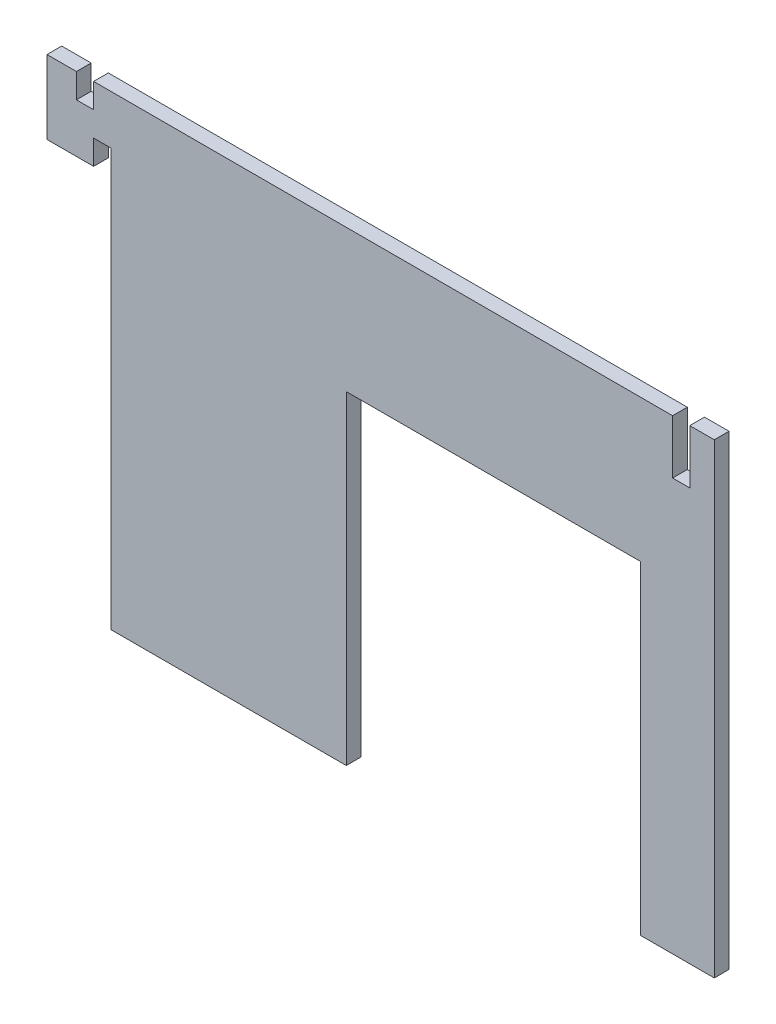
SolidWorks part; units mm, degrees
ref_plane "Plan de face" through (0, 0, 0) normal (0, 0, 1) x (1, 0, 0)
ref_plane "Plan de dessus" through (0, 0, 0) normal (0, 1, 0) x (1, 0, 0)
ref_plane "Plan de droite" through (0, 0, 0) normal (1, 0, 0) x (0, 0, -1)
sketch "Esquisse1" plane through (0, 0, 0) normal (0, 0, 1) x (1, 0, 0)
  line L1 (0, 0) -> (136, 0)
  line L2 (0, 0) -> (0, 95)
  line L3 (0, 95) -> (136, 95)
  line L4 (136, 0) -> (136, 95)
  dimension "D1" = 95
  dimension "D2" = 136
extrude "Extrusion1" add sketch "Esquisse1" along normal blind 3
sketch "Esquisse2" plane through (0, 0, 3) normal (0, 0, 1) x (1, 0, 0)
  line L0 (0, 95) -> (0, 0) construction
  line L1 (0, 80) -> (13, 80)
  line L2 (0, 80) -> (0, 0)
  line L3 (0, 0) -> (13, 0)
  line L4 (13, 80) -> (13, 0)
  line L5 (0, 0) -> (136, 0) construction
  dimension "D1" = 13
  dimension "D2" = 80
extrude "Enlèv. mat.-Extru.2" cut sketch "Esquisse2" against normal blind 3
sketch "Esquisse4" plane through (0, 0, 3) normal (0, 0, 1) x (1, 0, 0)
  line L0 (13, 0) -> (136, 0) construction
  line L1 (61, 0) -> (121, 0)
  line L2 (61, 0) -> (61, 66)
  line L3 (61, 66) -> (121, 66)
  line L4 (121, 0) -> (121, 66)
  dimension "D1" = 60
  dimension "D2" = 48
  dimension "D3" = 66
extrude "Enlèv. mat.-Extru.3" cut sketch "Esquisse4" against normal blind 3
sketch "Esquisse5" plane through (0, 0, 3) normal (0, 0, 1) x (1, 0, 0)
  line L0 (136, 95) -> (0, 95) construction
  line L1 (6, 95) -> (9.5, 95)
  line L2 (6, 95) -> (6, 90)
  line L3 (6, 90) -> (9.5, 90)
  line L4 (9.5, 95) -> (9.5, 90)
  dimension "D1" = 5
  dimension "D2" = 6
  dimension "D3" = 3.5
extrude "Enlèv. mat.-Extru.4" cut sketch "Esquisse5" against normal blind 3
sketch "Esquisse6" plane through (0, 0, 3) normal (0, 0, 1) x (1, 0, 0)
  line L1 (13, 80) -> (9.5, 80)
  line L2 (13, 80) -> (13, 85)
  line L3 (13, 85) -> (9.5, 85)
  line L4 (9.5, 80) -> (9.5, 85)
  dimension "D1" = 3.5
  dimension "D2" = 5
extrude "Enlèv. mat.-Extru.5" cut sketch "Esquisse6" against normal blind 3
sketch "Esquisse7" plane through (0, 0, 3) normal (0, 0, 1) x (1, 0, 0)
  line L0 (136, 95) -> (9.5, 95) construction
  line L1 (127.5, 95) -> (131, 95)
  line L2 (127.5, 95) -> (127.5, 84)
  line L3 (127.5, 84) -> (131, 84)
  line L4 (131, 95) -> (131, 84)
  dimension "D1" = 3.5
  dimension "D2" = 11
  dimension "D3" = 5
extrude "Enlèv. mat.-Extru.6" cut sketch "Esquisse7" against normal blind 3
